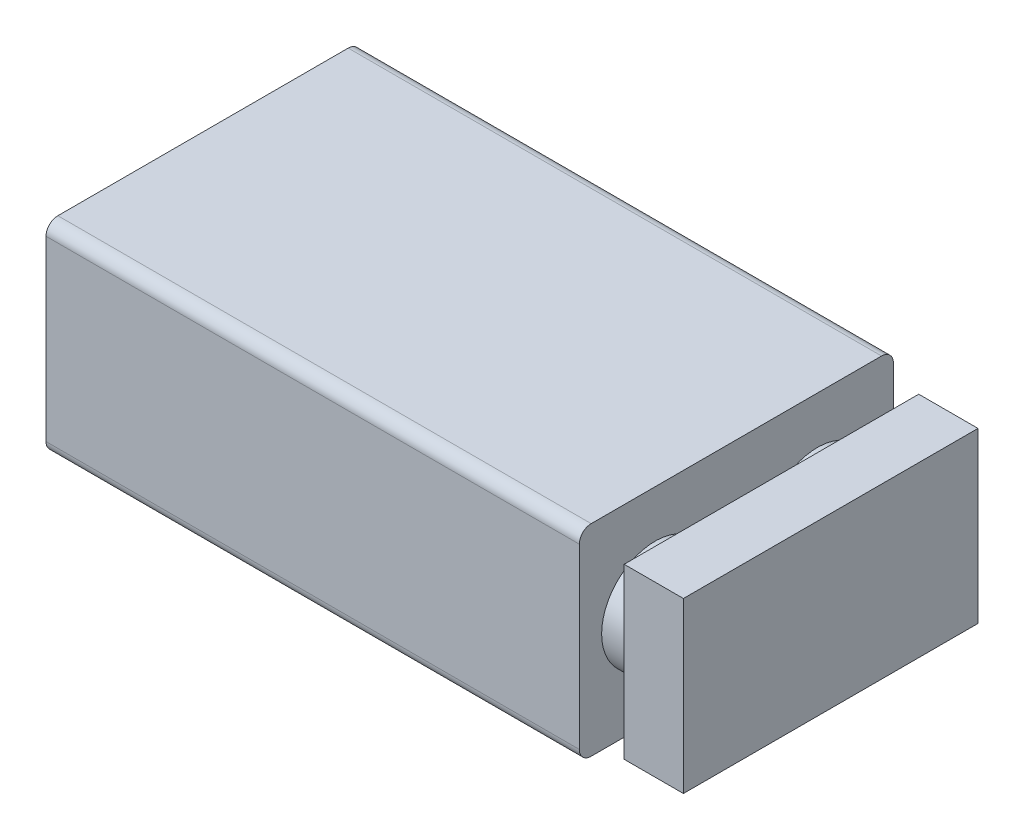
SolidWorks part; units mm, degrees
ref_plane "Plan de face" through (0, 0, 0) normal (0, 0, 1) x (1, 0, 0)
ref_plane "Plan de dessus" through (0, 0, 0) normal (0, 1, 0) x (1, 0, 0)
ref_plane "Plan de droite" through (0, 0, 0) normal (1, 0, 0) x (0, 0, -1)
sketch "Esquisse1" plane through (0, 0, 0) normal (0, 0, 1) x (1, 0, 0)
  line L1 (0, 0) -> (45, 0)
  line L2 (0, 0) -> (0, 17)
  line L3 (0, 17) -> (45, 17)
  line L4 (45, 0) -> (45, 17)
  dimension "D1" = 17
  dimension "D2" = 45
extrude "Boss.-Extru.1" add sketch "Esquisse1" along normal blind 26.5
sketch "Esquisse2" plane through (45, 0, 0) normal (1, 0, 0) x (0, 0, -1)
  line L0 (-26.5, 8.5) -> (0, 8.5) construction
  line L1 (-26.5, 0) -> (-26.5, 17) construction
  line L2 (0, 0) -> (0, 17) construction
  line L3 (-13.25, 17) -> (-13.25, 0) construction
  line L4 (-26.5, 17) -> (0, 17) construction
  line L5 (-26.5, 0) -> (0, 0) construction
  circle A0 centre (-20.095, 8.5) radius 4.523
  circle A1 centre (-6.405, 8.5) radius 4.523
extrude "Boss.-Extru.2" add sketch "Esquisse2" along normal blind 3
fillet "Congé1" radius 1 4 edges at (22.5, 17, 0) (22.5, 0, 0) (22.5, 17, 26.5) (22.5, 0, 26.5)
sketch "Esquisse3" plane through (48, 0, 0) normal (1, 0, 0) x (0, 0, -1)
  line L1 (-25.7178, 15.6396) -> (-0.8615, 15.6396)
  line L2 (-25.7178, 15.6396) -> (-25.7178, 1.3869)
  line L3 (-25.7178, 1.3869) -> (-0.8615, 1.3869)
  line L4 (-0.8615, 15.6396) -> (-0.8615, 1.3869)
extrude "Boss.-Extru.3" add sketch "Esquisse3" along normal blind 5
